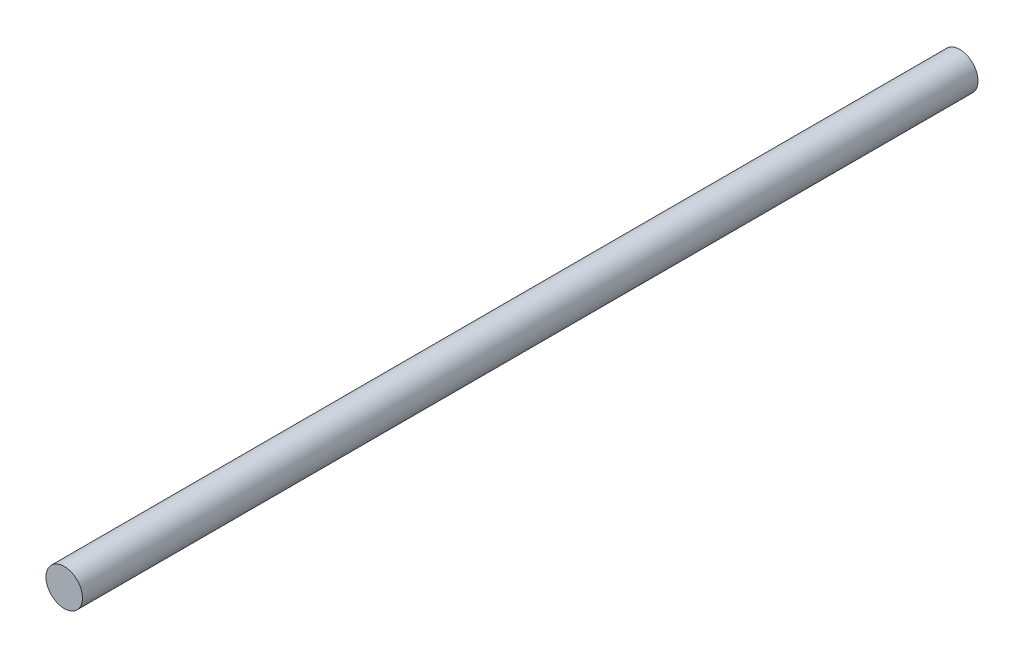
SolidWorks part; units mm, degrees
ref_plane "Front Plane" through (0, 0, 0) normal (0, 0, 1) x (1, 0, 0)
ref_plane "Top Plane" through (0, 0, 0) normal (0, 1, 0) x (1, 0, 0)
ref_plane "Right Plane" through (0, 0, 0) normal (1, 0, 0) x (0, 0, -1)
sketch "Sketch1" plane through (0, 0, 0) normal (0, 0, 1) x (1, 0, 0)
  circle A0 centre (0, 0) radius 15
  dimension "D1" = 30
extrude "Boss-Extrude1" add sketch "Sketch1" along normal blind 736
